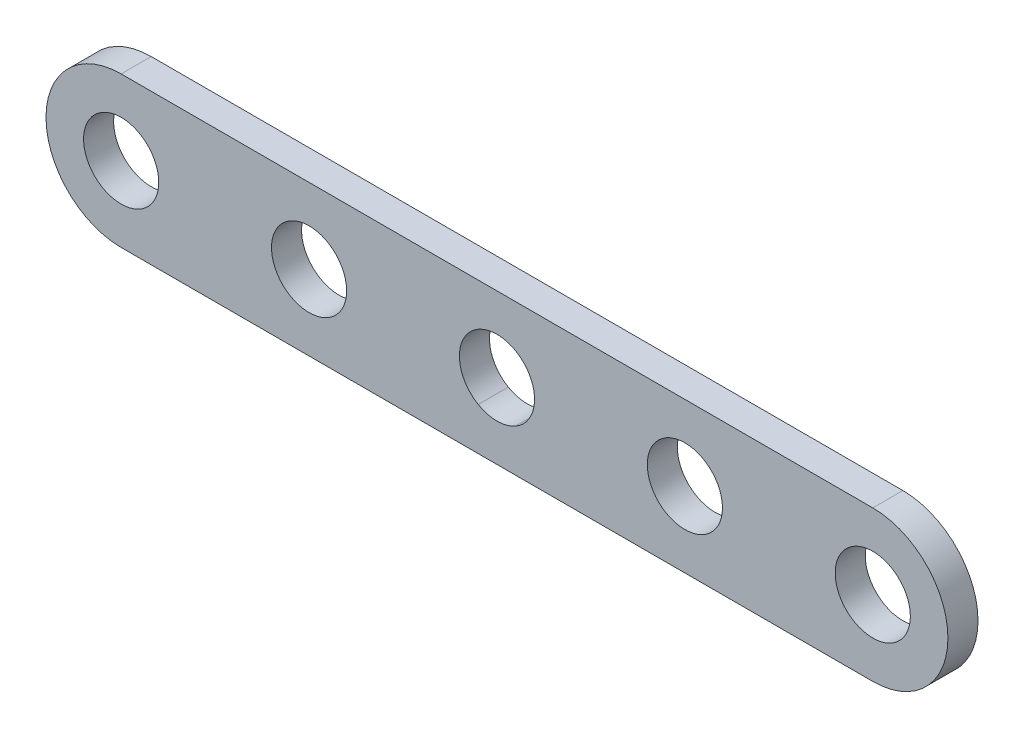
SolidWorks part; units mm, degrees
ref_plane "Front" through (0, 0, 0) normal (0, 0, 1) x (1, 0, 0)
ref_plane "Top" through (0, 0, 0) normal (0, 1, 0) x (1, 0, 0)
ref_plane "Right" through (0, 0, 0) normal (1, 0, 0) x (0, 0, -1)
sketch "Sketch1" plane through (0, 0, 0) normal (0, 0, 1) x (1, 0, 0)
  line L0 (250, 222.6284) -> (250, -151.5336) construction
  line L1 (0, 0) -> (500, 0)
  line L3 (0, 100) -> (500, 100)
  arc A0 (0, 100) -> (0, 0) centre (0, 50) ccw
  arc A1 (500, 100) -> (500, 0) centre (500, 50) cw
  point P1 (250, 0)
  point P10 (250, 100)
  dimension "D2" = 500
  dimension "D1" = 100
extrude "Base-Extrude" add sketch "Sketch1" along normal blind 20
sketch "Sketch2" plane through (0, 0, 20) normal (0, 0, 1) x (1, 0, 0)
  circle A0 centre (0, 50) radius 25
  arc A1 (0, 100) -> (0, 0) centre (0, 50) ccw construction
  dimension "D1" = 50
extrude "Cut-Extrude1" cut sketch "Sketch2" against normal through all
pattern_linear "LPattern1" count 5 spacing 125 along (1, 0, 0) of "Cut-Extrude1"
sketch "Sketch6" plane through (0, 0, 0) normal (0, 1, 0) x (1, 0, 0)
  line L0 (250, 24.303) -> (250, -37.3782) construction
  line L1 (250, 0) -> (250, -20) construction
  line L2 (500, -20) -> (0, -20) construction
  line L3 (500, 0) -> (0, 0) construction
  line L4 (262.5, -20) -> (237.5, -20)
  line L5 (262.5, 0) -> (237.5, 0)
  line L6 (262.5, 0) -> (262.5, -20)
  line L7 (237.5, 0) -> (237.5, -20)
  dimension "D1" = 25
fillet "Fillet1" [suppressed] radius 3
sketch "Sketch3" plane through (0, 0, 20) normal (0, 0, 1) x (1, 0, 0)
  line L0 (250, 189.4512) -> (250, -67.8587)
  circle A0 centre (0, 50) radius 25 construction
  dimension "D1" = 250
extrude "Cut-Extrude2" [suppressed] cut sketch "Sketch3" against normal through all and the other way through all
equation "\"D3@LPattern1\" = \"D2@Sketch1\" / (\"D1@LPattern1\"-1)"
